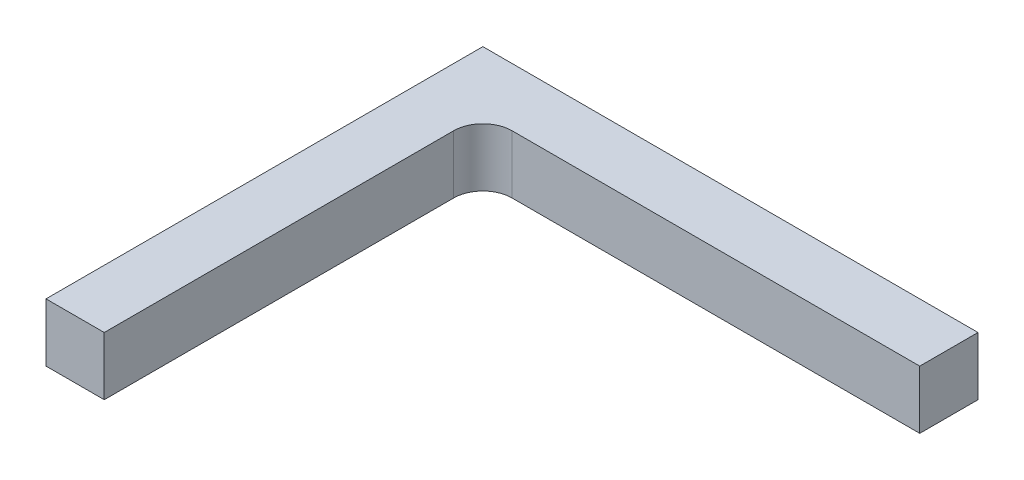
SolidWorks part; units mm, degrees
ref_plane "Piano frontale" through (0, 0, 0) normal (0, 0, 1) x (1, 0, 0)
ref_plane "Piano superiore" through (0, 0, 0) normal (0, 1, 0) x (1, 0, 0)
ref_plane "Piano destro" through (0, 0, 0) normal (1, 0, 0) x (0, 0, -1)
sketch "Schizzo1" plane through (0, 0, 0) normal (0, 0, 1) x (1, 0, 0)
  line L0 (0, 0) -> (200, 0)
  line L1 (200, 0) -> (200, -1300)
  line L2 (200, -1300) -> (1700, -1300)
  line L3 (1700, -1300) -> (1700, -1500)
  line L4 (1700, -1500) -> (0, -1500)
  line L5 (0, -1500) -> (0, 0)
  dimension "D1" = 200
  dimension "D2" = 1500
  dimension "D3" = 200
  dimension "D4" = 1500
extrude "Estrusione-Estrusione1" add sketch "Schizzo1" along normal blind 200
sketch "Schizzo2" plane through (0, 0, 0) normal (0, 0, 1) x (1, 0, 0)
  line L0 (100, 0) -> (100, -1500) construction
  line L1 (200, 0) -> (0, 0) construction
  line L2 (0, -1500) -> (1700, -1500) construction
  line L3 (0, -500) -> (200, -500) construction
  line L4 (0, 0) -> (0, -1500) construction
  line L5 (200, -1300) -> (200, 0) construction
  line L6 (0, -900) -> (200, -900) construction
  circle A0 centre (100, -900) radius 40
  circle A1 centre (100, -500) radius 40
  dimension "D3" = 80
  dimension "D4" = 80
  dimension "D1" = 600
  dimension "D2" = 400
extrude "Estrusione-Estrusione2" add sketch "Schizzo2" along normal blind 50 from surface at 200
fillet "Raccordo1" radius 100 1 edges at (200, -1300, 100)
move or copy body "Corpo-Sposta/copia1" bodies to move or copy 102 copy no rotation origin (0, -1250, 125) rotation axis (1, 0, 0) rotation angle 90
